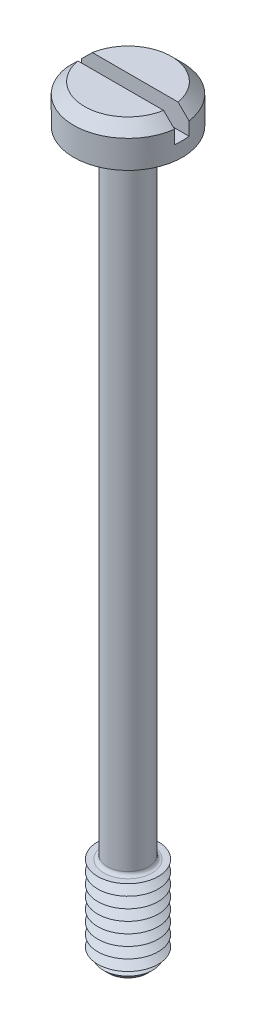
SolidWorks part; units mm, degrees
ref_plane "Front Plane" through (0, 0, 0) normal (0, 0, 1) x (1, 0, 0)
ref_plane "Top Plane" through (0, 0, 0) normal (0, 1, 0) x (1, 0, 0)
ref_plane "Right Plane" through (0, 0, 0) normal (1, 0, 0) x (0, 0, -1)
sketch "Sketch1" plane through (0, 0, 0) normal (0, 1, 0) x (1, 0, 0)
  circle A0 centre (0, 0) radius 2.25
  dimension "D1" = 4.5
extrude "Boss-Extrude1" add sketch "Sketch1" along normal blind 1.6
sketch "Sketch2" plane through (0, 0, 0) normal (0, -1, 0) x (1, 0, 0)
  circle A0 centre (0, 0) radius 0.85
  dimension "D1" = 1.7
extrude "Boss-Extrude2" add sketch "Sketch2" along normal blind 30
sketch "Sketch3" plane through (0, -30, 0) normal (0, -1, 0) x (1, 0, 0)
  circle A0 centre (0, 0) radius 1.25
  dimension "D1" = 2.5
extrude "Boss-Extrude3" add sketch "Sketch3" against normal blind 3.7
chamfer "Chamfer1" distance 0.45 angle 45 1 edges at (0, -30, -1.25)
sketch "Sketch4" plane through (0, 0, 0) normal (1, 0, 0) x (0, 0, -1)
  line L0 (0, -6.5871) -> (0, -12.0372) construction
sketch "Sketch5" plane through (0, 0, 0) normal (1, 0, 0) x (0, 0, -1)
  line L0 (-1.25, -26.3) -> (-0.8603, -26.525)
  line L1 (-0.8603, -26.525) -> (-1.25, -26.75)
  line L2 (-1.25, -26.3) -> (-1.25, -29.55) construction
  line L3 (-1.25, -26.75) -> (-1.25, -26.3)
  dimension "D1" = 0.45
revolve "Cut-Revolve1" cut sketch "Sketch5" angle 360 about L0
pattern_linear "LPattern1" count 8 spacing 0.45 along (0, -1, 0) of "Cut-Revolve1"
fillet "Fillet1" radius 0.15 2 edges at (0, -26.3, -0.85) (0, 0, -0.85)
chamfer "Chamfer2" distance 0.45 angle 45 1 edges at (0, 1.6, 2.25)
sketch "Sketch6" plane through (0, 1.6, 0) normal (0, 1, 0) x (1, 0, 0)
  line L1 (2.25, -0.3) -> (-2.25, -0.3)
  line L2 (2.25, -0.3) -> (2.25, 0.3)
  line L3 (2.25, 0.3) -> (-2.25, 0.3)
  line L4 (-2.25, -0.3) -> (-2.25, 0.3)
  line L5 (2.25, -0.3) -> (-2.25, 0.3) construction
  line L6 (2.25, 0.3) -> (-2.25, -0.3) construction
  circle A0 centre (0, 0) radius 2.25 construction
  point P0 (0, 0)
  dimension "D1" = 0.6
extrude "Cut-Extrude1" cut sketch "Sketch6" against normal blind 1
